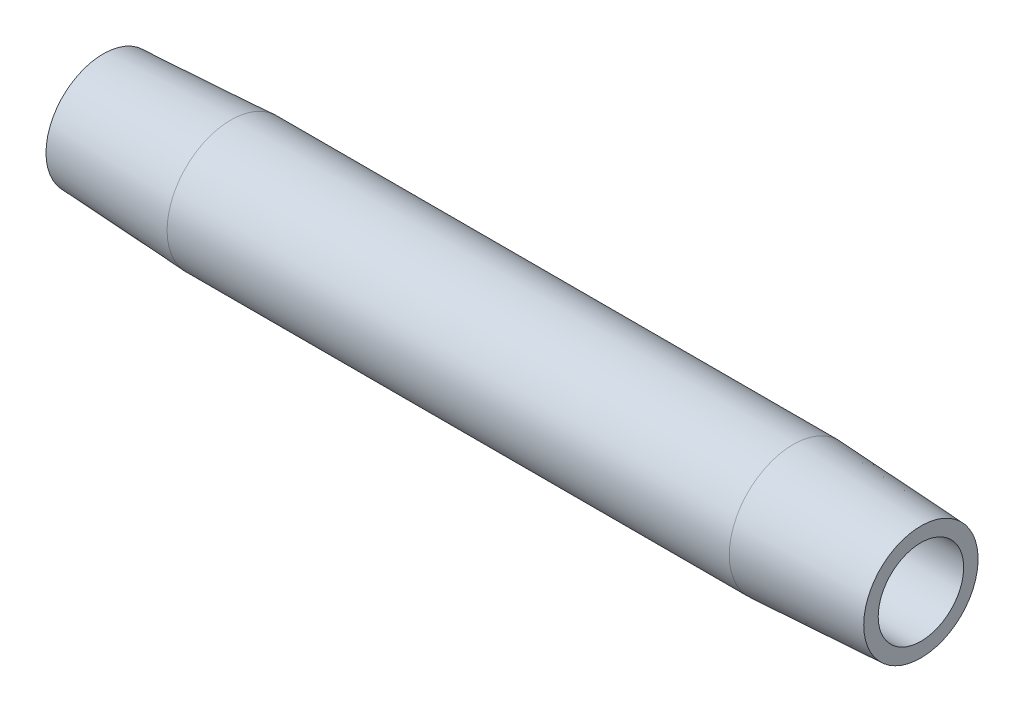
SolidWorks part; units mm, degrees
ref_plane "Front Plane" through (0, 0, 0) normal (0, 0, 1) x (1, 0, 0)
ref_plane "Top Plane" through (0, 0, 0) normal (0, 1, 0) x (1, 0, 0)
ref_plane "Right Plane" through (0, 0, 0) normal (1, 0, 0) x (0, 0, -1)
sketch "Sketch2" plane through (0, 0, 0) normal (0, 0, 1) x (1, 0, 0)
  line L0 (0.4761, 0) -> (50000.4761, 0) construction
  line L1 (0, -11.3625) -> (0, 49988.6375) construction
  line L7 (7.9375, 3.9687) -> (0, 3.5528)
  line L8 (42.8625, 3.9688) -> (7.9375, 3.9687)
  line L9 (50.8, 3.5528) -> (42.8625, 3.9688)
  line L10 (50.8, 2.6543) -> (50.8, 3.5528)
  line L11 (50.8, 2.6543) -> (0, 2.6543)
  line L12 (0, 3.5528) -> (0, 2.6543)
  dimension "D1" = 5.3086
  dimension "D2" = 7.9375
  dimension "D3" = 3
  dimension "D4" = 3
  dimension "D5" = 7.9375
  dimension "D6" = 7.9375
  dimension "D7" = 50.8
revolve "Revolve1" add sketch "Sketch2" angle 360 about L0
